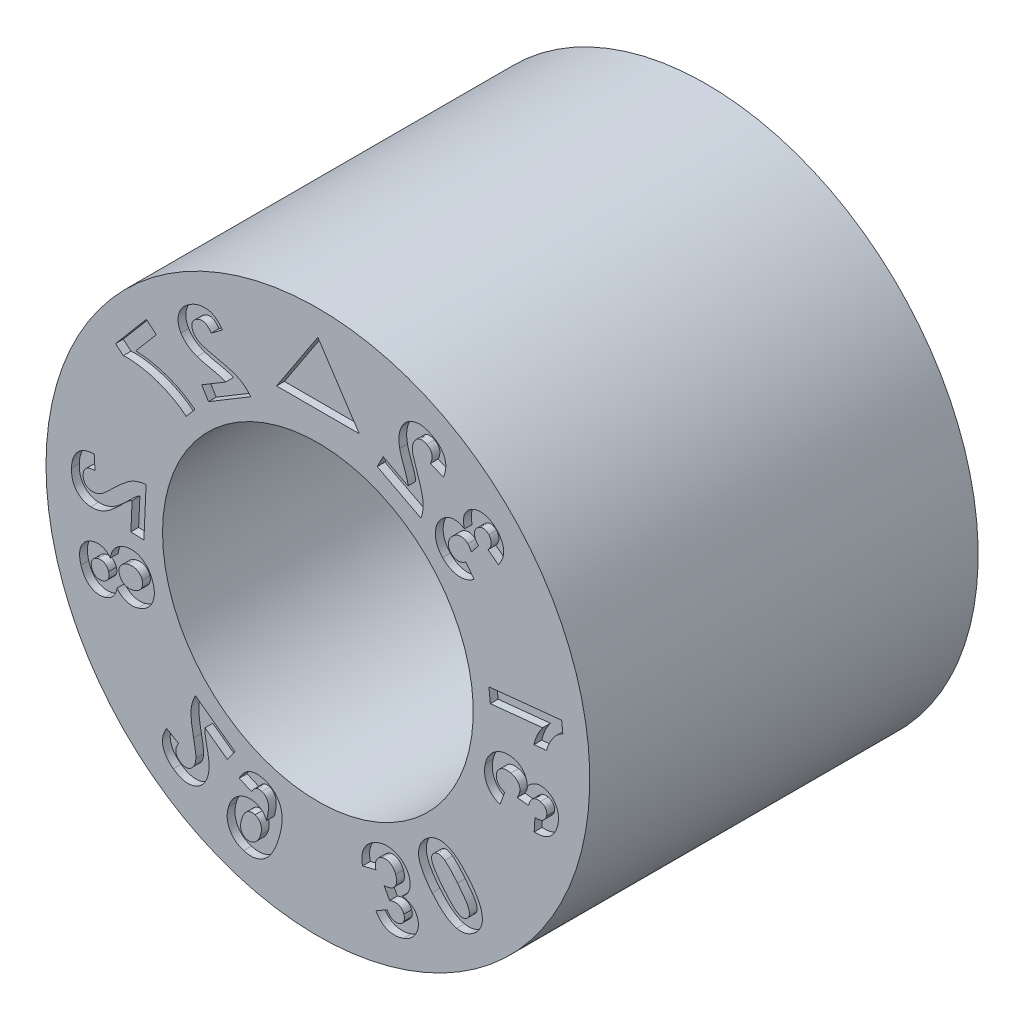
SolidWorks part; units mm, degrees
ref_plane "Front Plane" through (0, 0, 0) normal (0, 0, 1) x (1, 0, 0)
ref_plane "Top Plane" through (0, 0, 0) normal (0, 1, 0) x (1, 0, 0)
ref_plane "Right Plane" through (0, 0, 0) normal (1, 0, 0) x (0, 0, -1)
imported_body "Imported1"
other "Move Face1" parameters "D1"=0.22
other "DeleteFace2"
sketch "Sketch1" plane through (0, 0, 0) normal (0, 0, 1) x (1, 0, 0)
  arc A0 (-0.8358, 2.0974) -> (0.9668, 2.0403) centre (0, 0) ccw construction
  text T2 "27  28  29  30  31  32" font "Arial" height 0.95
extrude "Cut-Extrude1" cut sketch "Sketch1" against normal blind 0.1
